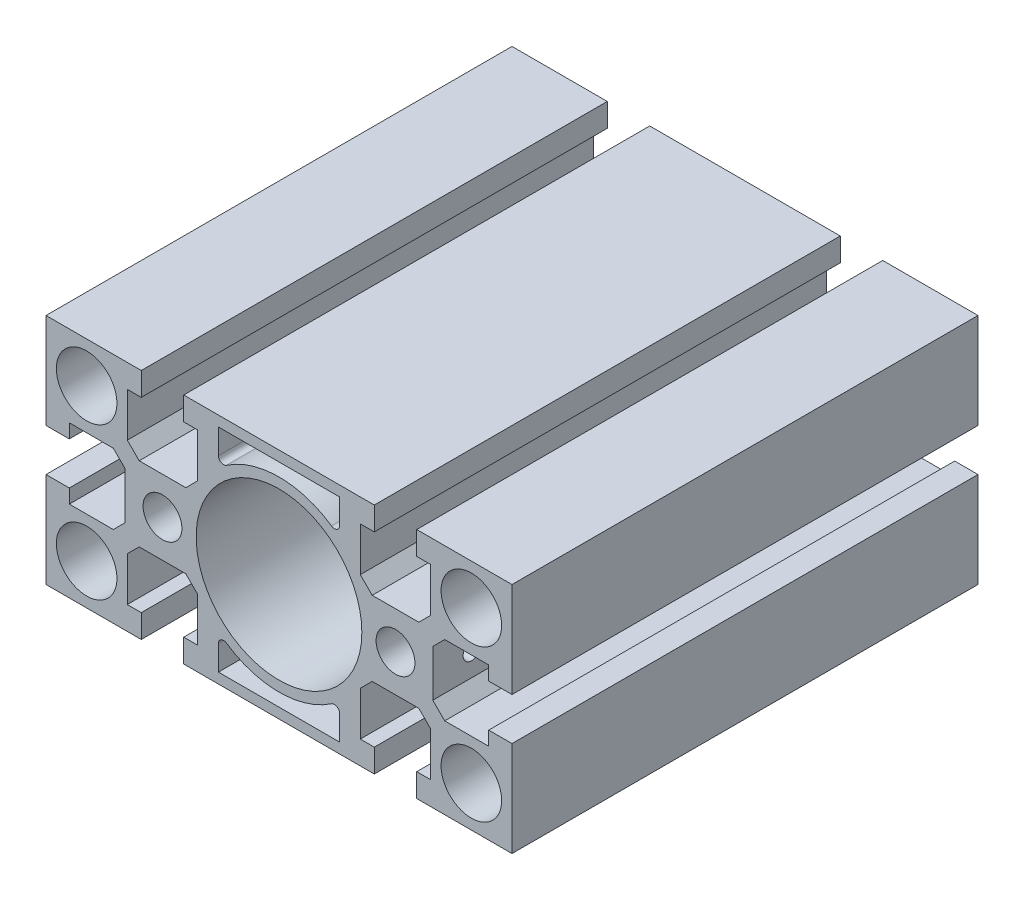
SolidWorks part; units mm, degrees
ref_plane "Front Plane" through (0, 0, 0) normal (0, 0, 1) x (1, 0, 0)
ref_plane "Top Plane" through (0, 0, 0) normal (0, 1, 0) x (1, 0, 0)
ref_plane "Right Plane" through (0, 0, 0) normal (1, 0, 0) x (0, 0, -1)
sketch "Sketch1" plane through (0, 0, 0) normal (0, 0, 1) x (1, 0, 0)
  line L3 (11.7, 20.5) -> (11.7, 15.7006)
  line L4 (-11.7, 20.5) -> (11.7, 20.5)
  line L5 (-11.7, 15.7006) -> (-11.7, 20.5)
  line L9 (11.7, -15.7006) -> (11.7, -20.5)
  line L10 (-11.7, -20.5) -> (-11.7, -15.7006)
  line L11 (11.7, -20.5) -> (-11.7, -20.5)
  line L128 (40.5, 6.8) -> (40.5, 4.1)
  line L129 (40.5, 4.1) -> (45, 4.1)
  line L130 (45, 4.1) -> (45, 22.5)
  line L131 (45, 22.5) -> (26.6, 22.5)
  line L132 (26.6, 22.5) -> (26.6, 18)
  line L133 (26.6, 18) -> (29.3, 18)
  line L134 (29.3, 18) -> (29.3, 9.5)
  line L135 (29.3, 9.5) -> (27, 7.2)
  line L136 (27, 7.2) -> (18, 7.2)
  line L137 (18, 7.2) -> (15.7, 9.5)
  line L138 (15.7, 9.5) -> (15.7, 18)
  line L139 (15.7, 18) -> (18.4, 18)
  line L140 (18.4, 18) -> (18.4, 22.5)
  line L141 (18.4, 22.5) -> (-18.4, 22.5)
  line L142 (-18.4, 22.5) -> (-18.4, 18)
  line L143 (-18.4, 18) -> (-15.7, 18)
  line L144 (-15.7, 18) -> (-15.7, 9.5)
  line L145 (-15.7, 9.5) -> (-18, 7.2)
  line L146 (-18, 7.2) -> (-27, 7.2)
  line L147 (-27, 7.2) -> (-29.3, 9.5)
  line L148 (-29.3, 9.5) -> (-29.3, 18)
  line L149 (-29.3, 18) -> (-26.6, 18)
  line L150 (-26.6, 18) -> (-26.6, 22.5)
  line L151 (-26.6, 22.5) -> (-45, 22.5)
  line L152 (-45, 22.5) -> (-45, 4.1)
  line L153 (-45, 4.1) -> (-40.5, 4.1)
  line L154 (-40.5, 4.1) -> (-40.5, 6.8)
  line L155 (-40.5, 6.8) -> (-32, 6.8)
  line L156 (-32, 6.8) -> (-29.7, 4.5)
  line L157 (-29.7, 4.5) -> (-29.7, -4.5)
  line L158 (-29.7, -4.5) -> (-32, -6.8)
  line L159 (-32, -6.8) -> (-40.5, -6.8)
  line L160 (-40.5, -6.8) -> (-40.5, -4.1)
  line L161 (-40.5, -4.1) -> (-45, -4.1)
  line L162 (-45, -4.1) -> (-45, -22.5)
  line L163 (-45, -22.5) -> (-26.6, -22.5)
  line L164 (-26.6, -22.5) -> (-26.6, -18)
  line L165 (-26.6, -18) -> (-29.3, -18)
  line L166 (-29.3, -18) -> (-29.3, -9.5)
  line L167 (-29.3, -9.5) -> (-27, -7.2)
  line L168 (-27, -7.2) -> (-18, -7.2)
  line L169 (-18, -7.2) -> (-15.7, -9.5)
  line L170 (-15.7, -9.5) -> (-15.7, -18)
  line L171 (-15.7, -18) -> (-18.4, -18)
  line L172 (-18.4, -18) -> (-18.4, -22.5)
  line L173 (-18.4, -22.5) -> (18.4, -22.5)
  line L174 (18.4, -22.5) -> (18.4, -18)
  line L175 (18.4, -18) -> (15.7, -18)
  line L176 (15.7, -18) -> (15.7, -9.5)
  line L177 (15.7, -9.5) -> (18, -7.2)
  line L178 (18, -7.2) -> (27, -7.2)
  line L179 (27, -7.2) -> (29.3, -9.5)
  line L180 (29.3, -9.5) -> (29.3, -18)
  line L181 (29.3, -18) -> (26.6, -18)
  line L182 (26.6, -18) -> (26.6, -22.5)
  line L183 (26.6, -22.5) -> (45, -22.5)
  line L184 (45, -22.5) -> (45, -4.1)
  line L185 (45, -4.1) -> (40.5, -4.1)
  line L186 (40.5, -4.1) -> (40.5, -6.8)
  line L187 (40.5, -6.8) -> (32, -6.8)
  line L188 (32, -6.8) -> (29.7, -4.5)
  line L189 (29.7, -4.5) -> (29.7, 4.5)
  line L190 (29.7, 4.5) -> (32, 6.8)
  line L191 (32, 6.8) -> (40.5, 6.8)
  circle A4 centre (37.15, 14.65) radius 5.85
  circle A5 centre (37.15, -14.65) radius 5.85
  circle A6 centre (-37.15, -14.65) radius 5.85
  circle A7 centre (-37.15, 14.65) radius 5.85
  arc A11 (-11.7, 15.7006) -> (-10.1368, 14.8743) centre (-10.7, 15.7006) ccw
  arc A12 (10.1368, 14.8743) -> (-10.1368, 14.8743) centre (0, 0) ccw
  arc A13 (10.1368, 14.8743) -> (11.7, 15.7006) centre (10.7, 15.7006) ccw
  circle A15 centre (0, 0) radius 16
  circle A18 centre (-22.5, 0) radius 3.75
  circle A19 centre (22.5, 0) radius 3.75
  arc A23 (11.7, -15.7006) -> (10.1368, -14.8743) centre (10.7, -15.7006) ccw
  arc A24 (-10.1368, -14.8743) -> (10.1368, -14.8743) centre (0, 0) ccw
  arc A25 (-10.1368, -14.8743) -> (-11.7, -15.7006) centre (-10.7, -15.7006) ccw
extrude "Extrude1" add sketch "Sketch1" along normal blind 90
sketch "Sketch2" plane through (45, 0, 0) normal (1, 0, 0) x (0, 0, -1)
  line L0 (-90, 4.1) -> (-90, 22.5) construction
  line L1 (-90, 22.5) -> (0, 22.5) construction
  line L2 (0, 4.1) -> (0, 22.5) construction
  point P0 (-82.5, 0)
  point P1 (-7.5, 0)
  dimension "D1" = 7.5
  dimension "D2" = 22.5
  dimension "D3" = 7.5
  dimension "D4" = 22.5
hole_wizard "M4 Tapped Hole1" positions "3DSketch1" profile "Sketch3" tap size "M4" standard "ISO"
sketch3d "3DSketch1"
  point P0 (45, 0, 82.5)
  point P3 (45, 0, 7.5)
sketch "Sketch3" plane through (45, 0, 82.5) normal (0, 1, 0) x (0, 0, -1)
  line L0 (0, 0) -> (0, 45.4414)
  line L1 (0, 45.4414) -> (1.65, 44.45)
  line L2 (1.65, 44.45) -> (1.65, 0)
  line L5 (1.65, 0) -> (0, 0)
  line L10 (0, 45.4414) -> (-1.65, 44.45) construction
  line L11 (0, -6.35) -> (0, 107.95) construction
  dimension "Tap Drill Dia." = 3.3
  dimension "Tap Drill Depth" = 44.45
  dimension "Drill Angle" = 118
